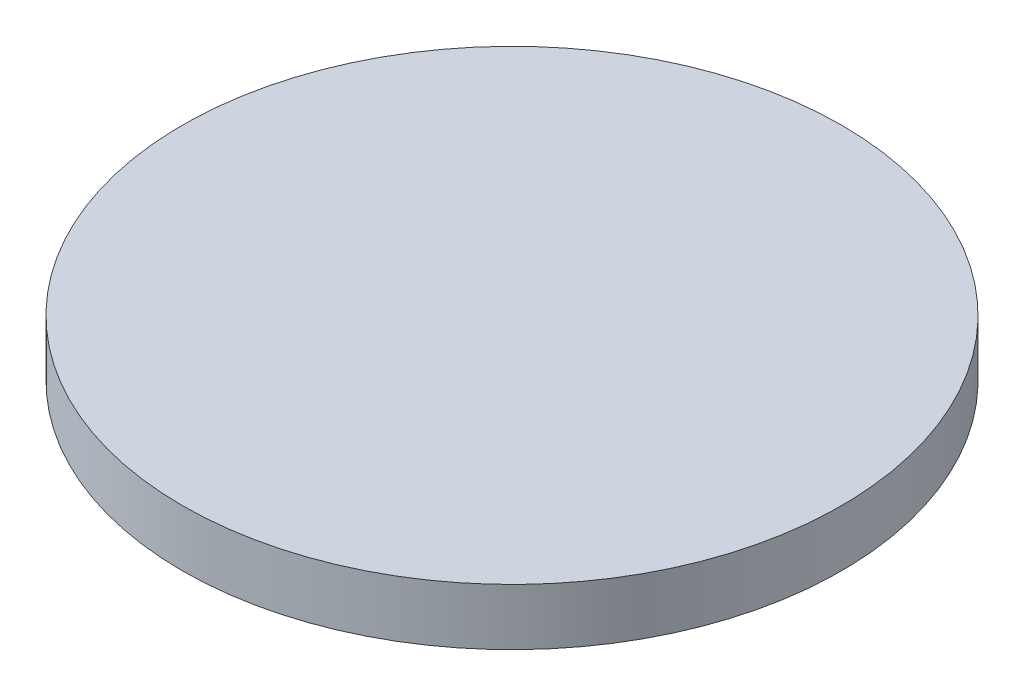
SolidWorks part; units mm, degrees
ref_plane "Face" through (0, 0, 0) normal (0, 0, 1) x (1, 0, 0)
ref_plane "Dessus" through (0, 0, 0) normal (0, 1, 0) x (1, 0, 0)
ref_plane "Droite" through (0, 0, 0) normal (1, 0, 0) x (0, 0, -1)
sketch "Esquisse1" plane through (0, 0, 0) normal (0, 1, 0) x (1, 0, 0)
  circle A0 centre (0, 0) radius 175
  dimension "D1" = 350
extrude "Extrusion1" add sketch "Esquisse1" along normal blind 30
